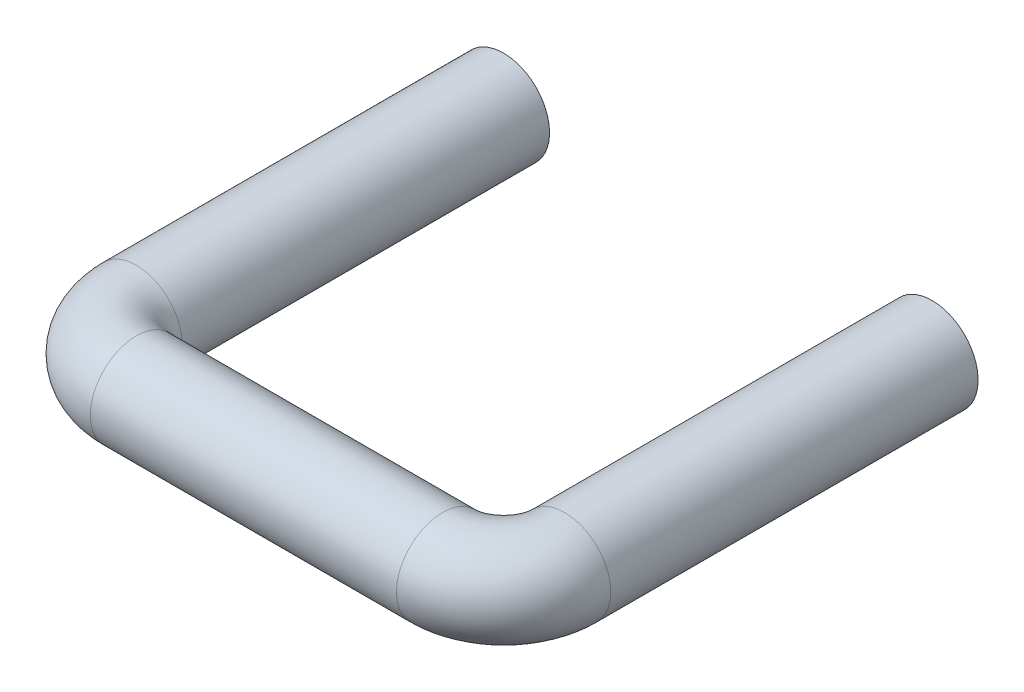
SolidWorks part; units mm, degrees
ref_plane "Front Plane" through (0, 0, 0) normal (0, 0, 1) x (1, 0, 0)
ref_plane "Top Plane" through (0, 0, 0) normal (0, 1, 0) x (1, 0, 0)
ref_plane "Right Plane" through (0, 0, 0) normal (1, 0, 0) x (0, 0, -1)
sketch "Sketch1" plane through (0, 0, 0) normal (0, 1, 0) x (1, 0, 0)
  line L0 (0, 0) -> (0, -60)
  line L1 (10, -70) -> (60, -70)
  line L2 (70, -60) -> (70, 0)
  arc A0 (0, -60) -> (10, -70) centre (10, -60) ccw
  arc A1 (60, -70) -> (70, -60) centre (60, -60) ccw
  dimension "D3" = 10
  dimension "D1" = 70
  dimension "D2" = 70
sketch "Sketch2" plane through (0, 0, 0) normal (0, 0, 1) x (1, 0, 0)
  circle A0 centre (0, 0) radius 7.5
  dimension "D1" = 15
sweep "Sweep1" add profiles "Sketch2" path "Sketch1"
